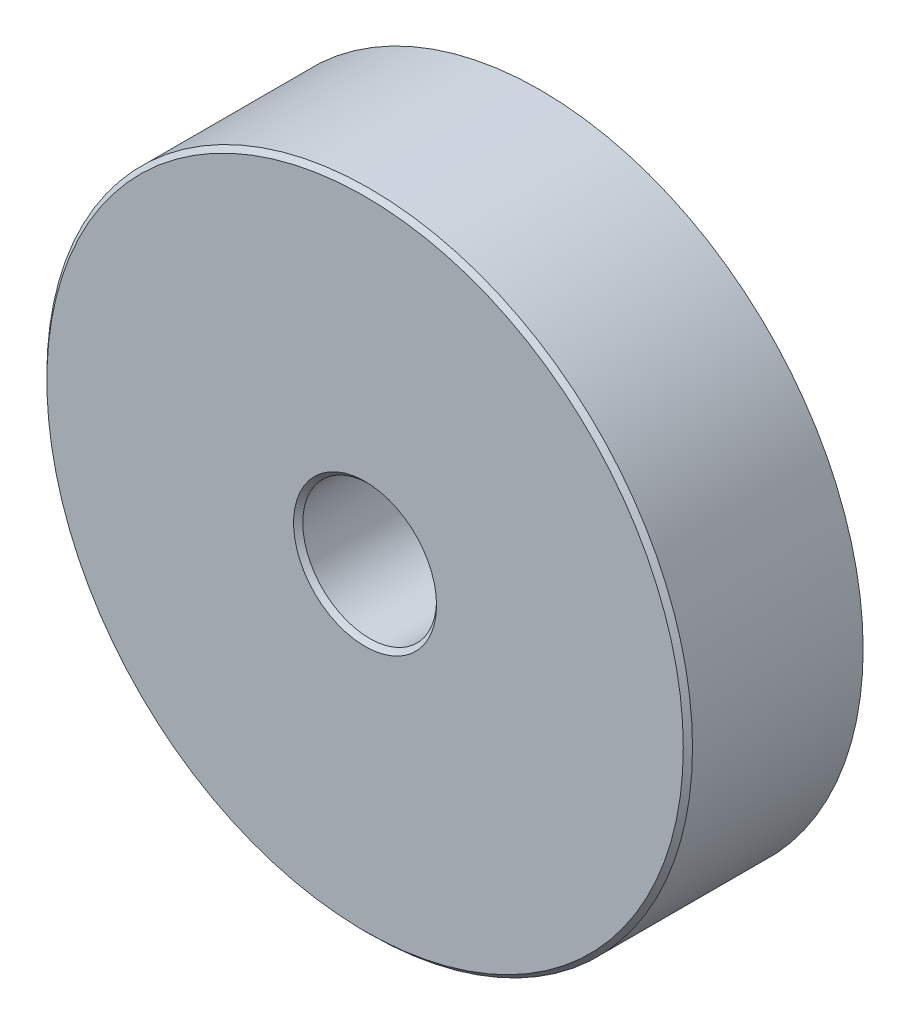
SolidWorks part; units mm, degrees
ref_plane "Спереди" through (0, 0, 0) normal (0, 0, 1) x (1, 0, 0)
ref_plane "Сверху" through (0, 0, 0) normal (0, 1, 0) x (1, 0, 0)
ref_plane "Справа" through (0, 0, 0) normal (1, 0, 0) x (0, 0, -1)
sketch "Эскиз1" plane through (0, 0, 0) normal (1, 0, 0) x (0, 0, -1)
  line L0 (-109.3974, 0) -> (125.0773, 0) construction
  line L1 (0, 79.9674) -> (0, -93.235) construction
  line L2 (0, 0) -> (0, -35)
  line L3 (0, -35) -> (19, -35)
  line L4 (19, -35) -> (32, -12)
  line L5 (32, -12) -> (32, 0)
  line L6 (32, 0) -> (0, 0)
  dimension "D1" = 32
  dimension "D2" = 19
  dimension "D3" = 24
  dimension "D4" = 70
revolve "Повернуть1" add sketch "Эскиз1" angle 360 about L0
sketch "Эскиз2" plane through (0, 0, -32) normal (0, 0, -1) x (-1, 0, 0)
  circle A0 centre (0, 0) radius 7.25
  dimension "D1" = 14.5
extrude "Вырез-Вытянуть1" cut sketch "Эскиз2" against normal through all
chamfer "Фаска1" distance 0.5 angle 45 2 edges at (35, 0, 0) (-7.25, 0, 0)
chamfer "Фаска2" distance 1.5 angle 45 1 edges at (-7.25, 0, -32)
sketch "Эскиз4" plane through (0, 0, 0) normal (0, 1, 0) x (1, 0, 0)
  line L0 (-35.6586, 38.4557) -> (-16.7799, 5.055) construction
  line L1 (-12, 32) -> (-35, 19) construction
  dimension "D1" = 90
  dimension "D2" = 9
sketch "Эскиз6" plane through (0, 0, 0) normal (0, 1, 0) x (1, 0, 0)
  line L2 (-35, 19) -> (-12, 32)
ref_plane "Плоскость1" through (-16.6132, 0, -29.3926) normal (0.4921, 0, 0.8706) x (0.8706, 0, -0.4921)
sketch "Эскиз10" plane through (-16.6132, 0, -29.3926) normal (0.4921, 0, 0.8706) x (0.8706, 0, -0.4921)
  line L0 (-53.8298, 0) -> (61.5452, 0) construction
  circle A0 centre (-12.139, 0) radius 4.5
  dimension "D1" = 9
extrude "Вырез-Вытянуть2" cut sketch "Эскиз10" along normal blind 20
chamfer "Фаска3" distance 1.5 angle 45 1 edges at (-26.5991, 4.4644, -23.538)
pattern_circular "Круговой массив2" count 8 over 360 about axis through (0, 0, 109.3974) along (0, 0, -1) of "Фаска3", "Вырез-Вытянуть2"
